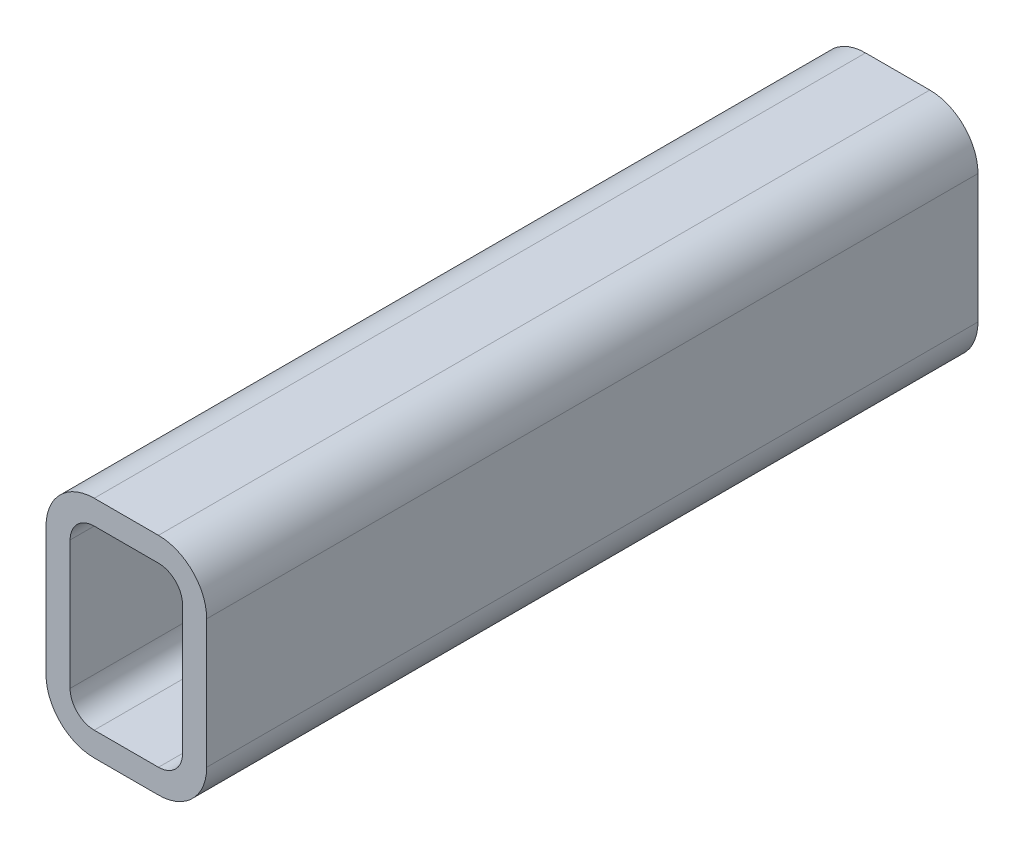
SolidWorks part; units mm, degrees
ref_plane "Front Plane" through (0, 0, 0) normal (0, 0, 1) x (1, 0, 0)
ref_plane "Top Plane" through (0, 0, 0) normal (0, 1, 0) x (1, 0, 0)
ref_plane "Right Plane" through (0, 0, 0) normal (1, 0, 0) x (0, 0, -1)
sketch "Sketch1" plane through (0, 0, 0) normal (0, 0, 1) x (1, 0, 0)
sketch_block_instance "HSS3.5x2.5x0.375-1"
sketch_block "HSS3.5x2.5x0.375"
extrude "Boss-Extrude1" add sketch "Sketch1" along normal blind 304.8
